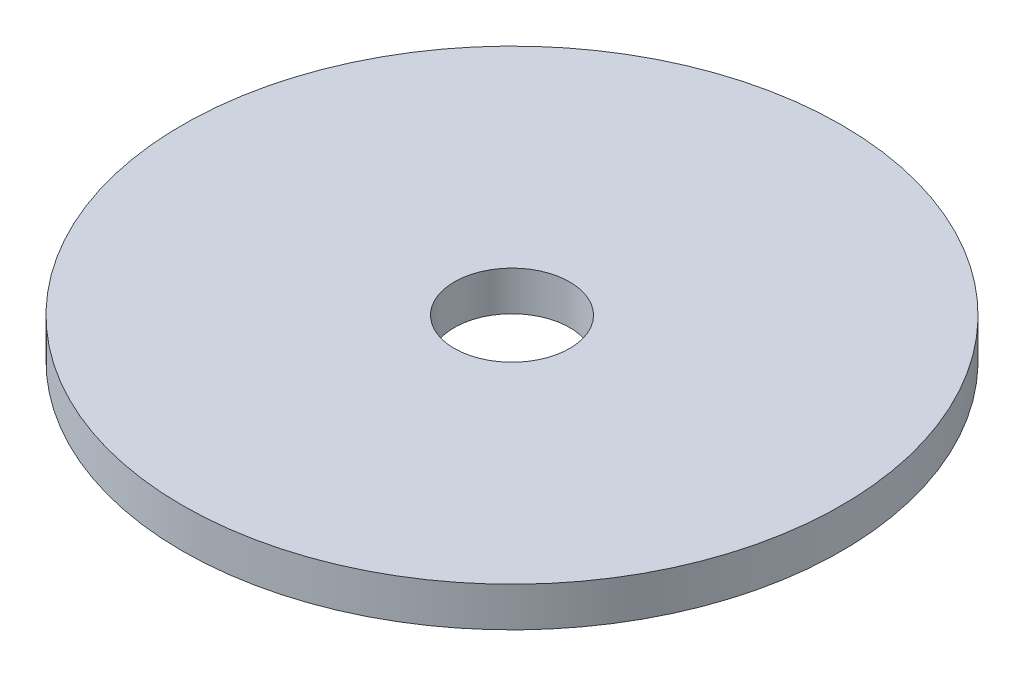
SolidWorks part; units mm, degrees
ref_plane "Ebene vorne" through (0, 0, 0) normal (0, 0, 1) x (1, 0, 0)
ref_plane "Ebene oben" through (0, 0, 0) normal (0, 1, 0) x (1, 0, 0)
ref_plane "Ebene rechts" through (0, 0, 0) normal (1, 0, 0) x (0, 0, -1)
sketch "Sketch1" plane through (0, 0, 0) normal (0, 1, 0) x (1, 0, 0)
  circle A0 centre (0, 0) radius 10
  circle A1 centre (0, 0) radius 1.75
  dimension "D1" = 3.5
  dimension "D2" = 20
extrude "Boss-Extrude1" add sketch "Sketch1" along normal blind 1.2
